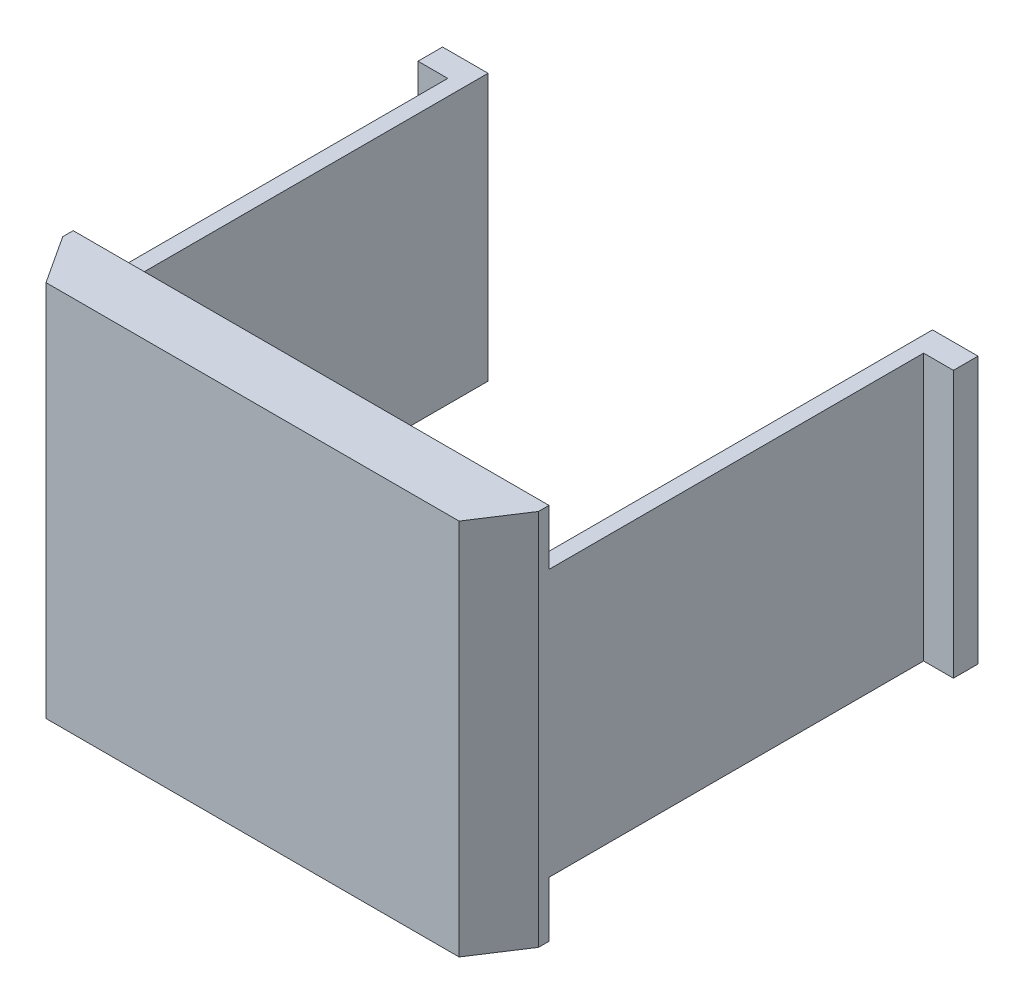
SolidWorks part; units mm, degrees
ref_plane "Alzado" through (0, 0, 0) normal (0, 0, 1) x (1, 0, 0)
ref_plane "Planta" through (0, 0, 0) normal (0, 1, 0) x (1, 0, 0)
ref_plane "Vista lateral" through (0, 0, 0) normal (1, 0, 0) x (0, 0, -1)
ref_plane "Plano1" through (0, 33.1, 0) normal (0, 1, 0) x (1, 0, 0)
sketch "Croquis1" plane through (0, 33.1, 0) normal (0, 1, 0) x (1, 0, 0)
  line L0 (42.5, -2.5) -> (41, -4)
  line L1 (41, -4) -> (1.5, -4)
  line L2 (1.5, -4) -> (0, -2.5)
  line L3 (0, -2.5) -> (0, -5.6)
  line L4 (0, -5.6) -> (42.5, -5.6)
  line L5 (42.5, -5.6) -> (42.5, -2.5)
extrude "Saliente-Extruir1" add sketch "Croquis1" against normal blind 33.1
sketch "Croquis2" plane through (0, 0, 4) normal (0, 0, -1) x (-1, 0, 0)
  line L0 (-1.5, 0) -> (-1.5, 33.1)
  line L1 (-1.5, 33.1) -> (-41, 33.1)
  line L2 (-41, 33.1) -> (-41, 0)
  line L3 (-41, 0) -> (-1.5, 0)
extrude "Cortar-Extruir1" cut sketch "Croquis2" against normal blind 0.1
ref_plane "Plano2" through (0, 0, 0) normal (0, -1, 0) x (-1, 0, 0)
sketch "Croquis7" plane through (0, 0, 0) normal (0, -1, 0) x (-1, 0, 0)
  line L0 (0, -5.6) -> (-42.5, -5.6)
  line L1 (-42.5, -5.6) -> (-42.5, 0)
  line L2 (-42.5, 0) -> (0, 0)
  line L3 (0, 0) -> (0, -5.6)
extrude "Saliente-Extruir2" add sketch "Croquis7" along normal blind 1.5
ref_plane "Plano3" through (0, 0, 0) normal (-1, 0, 0) x (0, 0, 1)
sketch "Croquis13" plane through (0, 0, 0) normal (-1, 0, 0) x (0, 0, 1)
  line L0 (5.6, 33.1) -> (5.6, -1.5)
  line L1 (5.6, -1.5) -> (0, -1.5)
  line L2 (0, -1.5) -> (0, 33.1)
  line L3 (0, 33.1) -> (5.6, 33.1)
extrude "Saliente-Extruir3" add sketch "Croquis13" along normal blind 1.5
ref_plane "Plano4" through (42.5, 0, 0) normal (1, 0, 0) x (0, 0, -1)
sketch "Croquis20" plane through (42.5, 0, 0) normal (1, 0, 0) x (0, 0, -1)
  line L0 (0, 33.1) -> (0, -1.5)
  line L1 (0, -1.5) -> (-5.6, -1.5)
  line L2 (-5.6, -1.5) -> (-5.6, 33.1)
  line L3 (-5.6, 33.1) -> (0, 33.1)
extrude "Saliente-Extruir4" add sketch "Croquis20" along normal blind 1.5
sketch "Croquis21" plane through (0, 33.1, 0) normal (0, 1, 0) x (-1, 0, 0)
  line L0 (-44, 0) -> (-44, 5.6)
  line L1 (-44, 5.6) -> (1.5, 5.6)
  line L2 (1.5, 5.6) -> (1.5, 0)
  line L3 (1.5, 0) -> (-44, 0)
extrude "Saliente-Extruir5" add sketch "Croquis21" along normal blind 1.5
sketch "Croquis22" plane through (0, 0, 0) normal (0, 0, -1) x (-1, 0, 0)
  line L0 (-44, 3.8) -> (-44, 29.3)
  line L1 (-44, 29.3) -> (-42.5, 29.3)
  line L2 (-42.5, 29.3) -> (-42.5, 3.8)
  line L3 (-42.5, 3.8) -> (-44, 3.8)
extrude "Saliente-Extruir6" add sketch "Croquis22" along normal blind 38.17
sketch "Croquis23" plane through (44, 0, 0) normal (1, 0, 0) x (0, 0, -1)
  line L0 (35.82, 3.8) -> (35.82, 29.3)
  line L1 (35.82, 29.3) -> (38.17, 29.3)
  line L2 (38.17, 29.3) -> (38.17, 3.8)
  line L3 (38.17, 3.8) -> (35.82, 3.8)
extrude "Saliente-Extruir7" add sketch "Croquis23" along normal blind 2.85
sketch "Croquis24" plane through (0, 0, 0) normal (0, 0, -1) x (-1, 0, 0)
  line L0 (1.5, 29.3) -> (1.5, 3.8)
  line L1 (1.5, 3.8) -> (0, 3.8)
  line L2 (0, 3.8) -> (0, 29.3)
  line L3 (0, 29.3) -> (1.5, 29.3)
extrude "Saliente-Extruir8" add sketch "Croquis24" along normal blind 38.17
sketch "Croquis25" plane through (-1.5, 0, 0) normal (-1, 0, 0) x (0, 0, 1)
  line L0 (-35.82, 29.3) -> (-35.82, 3.8)
  line L1 (-35.82, 3.8) -> (-38.17, 3.8)
  line L2 (-38.17, 3.8) -> (-38.17, 29.3)
  line L3 (-38.17, 29.3) -> (-35.82, 29.3)
extrude "Saliente-Extruir9" add sketch "Croquis25" along normal blind 2.85
chamfer "Chaflán1" distance 3 angle 56.889 1 edges at (44, 16.55, 5.6)
chamfer "Chaflán2" distance 4.6 angle 33.111 1 edges at (-1.5, 16.55, 5.6)
